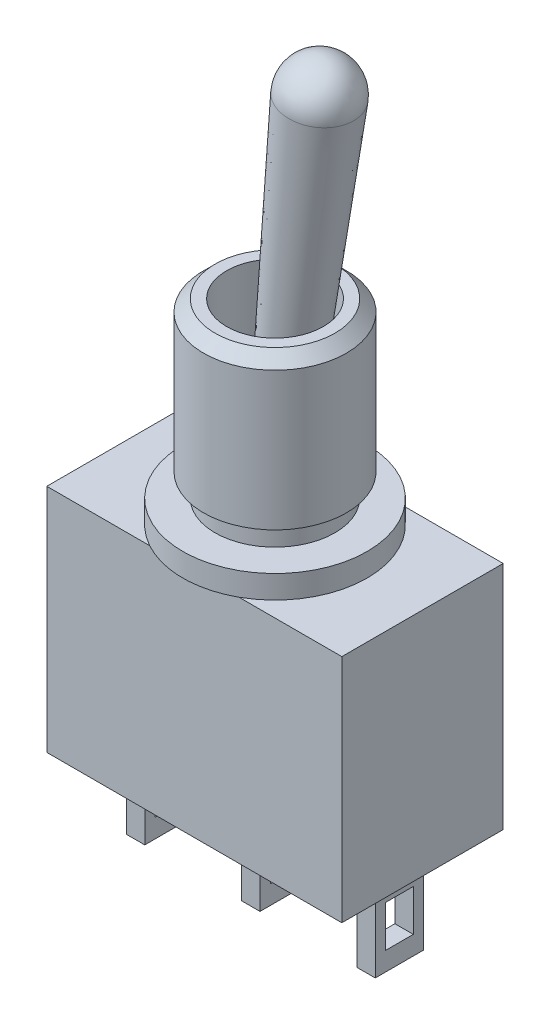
SolidWorks part; units mm, degrees
ref_plane "Vorne" through (0, 0, 0) normal (0, 0, 1) x (1, 0, 0)
ref_plane "Oben" through (0, 0, 0) normal (0, 1, 0) x (1, 0, 0)
ref_plane "Rechts" through (0, 0, 0) normal (1, 0, 0) x (0, 0, -1)
sketch "Sketch1" plane through (0, 0, 0) normal (0, 0, 1) x (1, 0, 0)
  line L1 (6.4, -5) -> (-6.4, -5)
  line L2 (6.4, -5) -> (6.4, 5)
  line L3 (6.4, 5) -> (-6.4, 5)
  line L4 (-6.4, -5) -> (-6.4, 5)
  line L5 (6.4, -5) -> (-6.4, 5) construction
  line L6 (6.4, 5) -> (-6.4, -5) construction
  point P0 (0, 0)
  dimension "D1" = 12.8
  dimension "D2" = 10
extrude "Boss-Extrude1" add sketch "Sketch1" along normal mid plane 7
sketch "Sketch3" plane through (0, 0, 0) normal (0, 0, 1) x (1, 0, 0)
  line L0 (0, 5) -> (0, 8.1)
  line L1 (6.4, 5) -> (-6.4, 5) construction
  line L2 (2.6, 13.5) -> (3.1, 13)
  line L3 (2.1, 6) -> (2.1, 13.5)
  line L4 (2.1, 13.5) -> (2.6, 13.5)
  line L5 (3.1, 13) -> (3.1, 7)
  line L6 (2.6, 7) -> (2.6, 6)
  line L7 (2.6, 6) -> (4, 6)
  line L8 (4, 6) -> (4, 5)
  line L9 (4, 5) -> (0, 5)
  line L10 (2.6, 7) -> (3.1, 7)
  arc A0 (2.1, 6) -> (0, 8.1) centre (0, 6) ccw
  point P8 (3.1, 13.5)
  dimension "D1" = 4
  dimension "D2" = 1
  dimension "D3" = 2.6
  dimension "D4" = 3.1
  dimension "D5" = 1
  dimension "D6" = 1
  dimension "D7" = 8.5
revolve "Revolve1" add sketch "Sketch3" angle 360 about L0
sketch "Sketch4" plane through (0, 0, 0) normal (1, 0, 0) x (0, 0, -1)
  line L0 (-3.5, -5) -> (3.5, -5) construction
  line L1 (1.05, -8.8) -> (-1.05, -8.8)
  line L2 (1.05, -8.8) -> (1.05, -5)
  line L3 (1.05, -5) -> (-1.05, -5)
  line L4 (-1.05, -8.8) -> (-1.05, -5)
  line L5 (1.05, -8.8) -> (-1.05, -5) construction
  line L6 (1.05, -5) -> (-1.05, -8.8) construction
  line L8 (0.6, -7.9857) -> (-0.6, -7.9857)
  line L9 (0.6, -7.9857) -> (0.6, -6.1857)
  line L10 (0.6, -6.1857) -> (-0.6, -6.1857)
  line L11 (-0.6, -7.9857) -> (-0.6, -6.1857)
  line L12 (0.6, -7.9857) -> (-0.6, -6.1857) construction
  line L13 (0.6, -6.1857) -> (-0.6, -7.9857) construction
  point P0 (0, -6.9)
  point P7 (0, -7.0857)
  dimension "D1" = 2.1
  dimension "D2" = 3.8
  dimension "D3" = 1.8
  dimension "D4" = 1.2
extrude "Boss-Extrude2" add sketch "Sketch4" along normal mid plane 0.8 contours L1 L4 L3 L2
pattern_linear "LPattern1" count 2 spacing 5 along (1, 0, 0) count 2 spacing 5 along (-1, 0, 0) of "Boss-Extrude2"
sketch "Sketch5" plane through (0, 0, 0) normal (0, 0, 1) x (1, 0, 0)
  line L0 (0, 6.1115) -> (2.1131, 23.6138)
  line L2 (3.416, 21.8912) -> (0.9237, 6)
  line L3 (2.1, 13.5) -> (0.9145, 13.6859) construction
  line L4 (2.1, 6) -> (-2.1, 6) construction
  line L6 (0, 6.1115) -> (0.9237, 6)
  arc A0 (2.1131, 23.6138) -> (3.416, 21.8912) centre (1.9332, 22.1237) cw
  point P2 (0, 6.1115)
  point P6 (2.1, 13.5)
  dimension "D1" = 1.5
  dimension "D2" = 1.2
  dimension "D3" = 10
revolve "Revolve4" add sketch "Sketch5" angle 360 about L0
